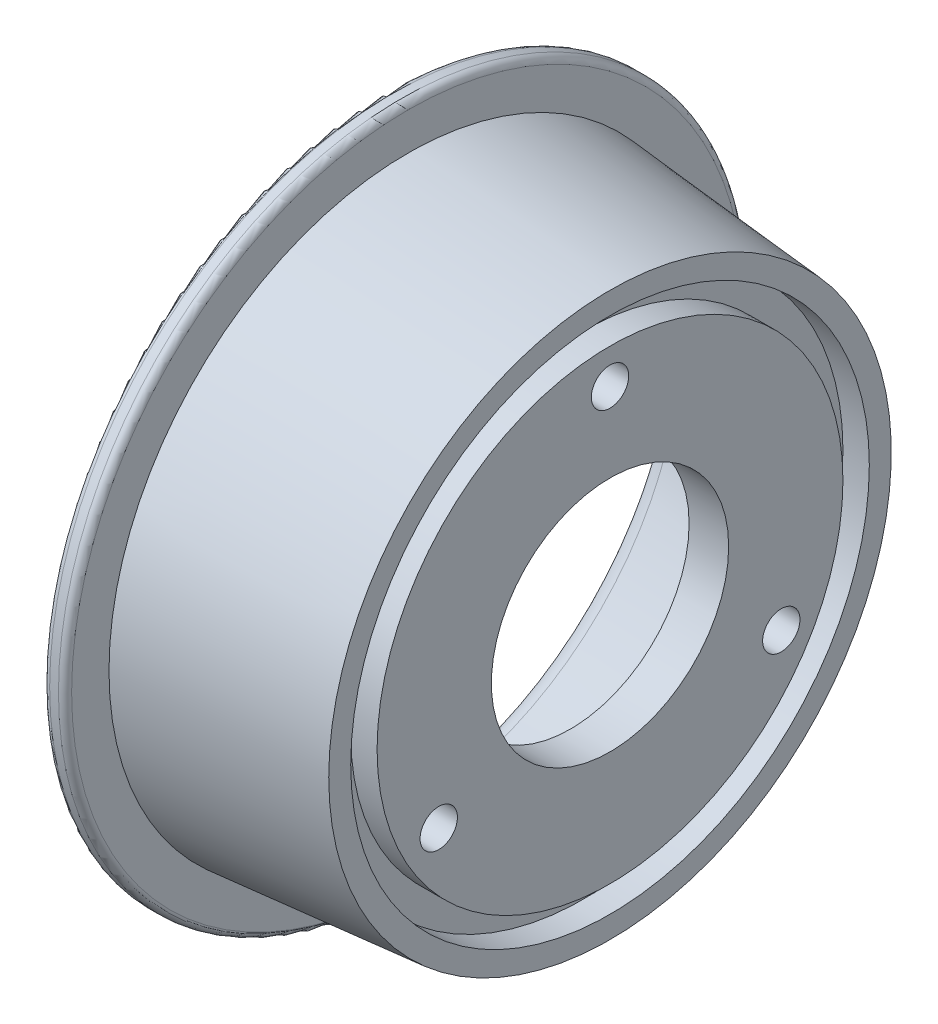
SolidWorks part; units mm, degrees
ref_plane "Plan1" through (0, 0, 0) normal (0, 0, 1) x (1, 0, 0)
ref_plane "Plan2" through (0, 0, 0) normal (0, 1, 0) x (1, 0, 0)
ref_plane "Plan3" through (0, 0, 0) normal (1, 0, 0) x (0, 0, -1)
sketch "Esquisse1" plane through (0, 0, 0) normal (0, 0, 1) x (1, 0, 0)
  line L0 (-57.1925, -53.6934) -> (-48.1925, -53.6934)
  line L1 (-48.1925, -53.6934) -> (-48.1925, -0.6934)
  line L2 (-97.6925, 24.3066) -> (-95.6925, 24.3066)
  line L3 (-57.1925, 5.8066) -> (-94.6077, 8.9246)
  line L4 (-99.1925, 13.9073) -> (-99.1925, 22.8066)
  line L5 (-94.1925, 22.8066) -> (-94.1925, 14.3066)
  line L6 (-94.1925, 14.3066) -> (-48.1925, 10.3066)
  line L7 (-57.1925, 5.8066) -> (-57.1925, -53.6934)
  line L8 (-48.1925, -53.6934) -> (11.2597, -53.6934) construction
  line L9 (-48.1925, 5.3066) -> (-54.1925, 5.3066)
  line L10 (-54.1925, 5.3066) -> (-54.1925, -0.6934)
  line L11 (-54.1925, -0.6934) -> (-48.1925, -0.6934)
  line L12 (-48.1925, 5.3066) -> (-48.1925, 10.3066)
  arc A0 (-99.1925, 13.9073) -> (-94.6077, 8.9246) centre (-94.1925, 13.9073) ccw
  arc A1 (-94.1925, 22.8066) -> (-95.6925, 24.3066) centre (-95.6925, 22.8066) ccw
  arc A2 (-97.6925, 24.3066) -> (-99.1925, 22.8066) centre (-97.6925, 22.8066) ccw
  point P10 (-99.1925, 9.3066)
  point P13 (-94.1925, 24.3066)
  point P16 (-99.1925, 24.3066)
  dimension "D9" = 5
  dimension "D10" = 1.5
  dimension "D1" = 64
  dimension "D2" = 59.5
  dimension "D3" = 9
  dimension "D4" = 51
  dimension "D5" = 5
  dimension "D6" = 68
  dimension "D7" = 10
  dimension "D8" = 15
  dimension "D11" = 6
  dimension "D12" = 6
  dimension "D13" = 53
revolve "Base-Révolution" add sketch "Esquisse1" angle 360 about L8
sketch "Esquisse2" plane through (-48.1925, 0, 0) normal (1, 0, 0) x (0, 0, -1)
  line L0 (0, -53.6934) -> (-106.5249, -53.6934) construction
  circle A0 centre (0, -53.6934) radius 27
  circle A1 centre (0, -53.6934) radius 64 construction
  dimension "D1" = 54
extrude "Enlèv. mat.-Extru.1" cut sketch "Esquisse2" against normal through all
sketch "Esquisse3" plane through (-48.1925, 0, 0) normal (1, 0, 0) x (0, 0, -1)
  line L0 (0, -53.6934) -> (-38.9711, -76.1934) construction
  line L1 (0, -53.6934) -> (0, 30) construction
  circle A0 centre (-38.9711, -76.1934) radius 4.25
  dimension "D1" = 8.5
  dimension "D2" = 120
  dimension "D3" = 45
extrude "Enlèv. mat.-Extru.2" cut sketch "Esquisse3" against normal through all
pattern_circular "Répétition circulaire1" count 3 every 120
